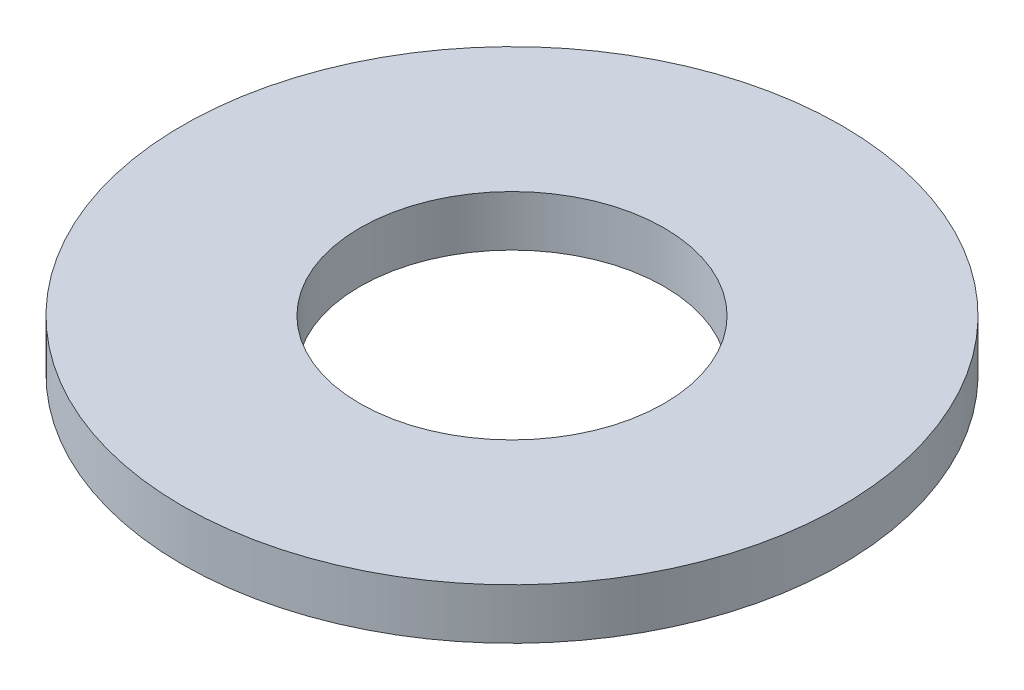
SolidWorks part; units mm, degrees
ref_plane "正面" through (0, 0, 0) normal (0, 0, 1) x (1, 0, 0)
ref_plane "平面" through (0, 0, 0) normal (0, 1, 0) x (1, 0, 0)
ref_plane "右側面" through (0, 0, 0) normal (1, 0, 0) x (0, 0, -1)
sketch "ｽｹｯﾁ1" plane through (0, 0, 0) normal (0, 1, 0) x (1, 0, 0)
  circle A0 centre (0, 0) radius 6.5
  circle A1 centre (0, 0) radius 3
  dimension "D1" = 6
  dimension "D2" = 13
extrude "ﾎﾞｽ - 押し出し1" add sketch "ｽｹｯﾁ1" along normal blind 1
